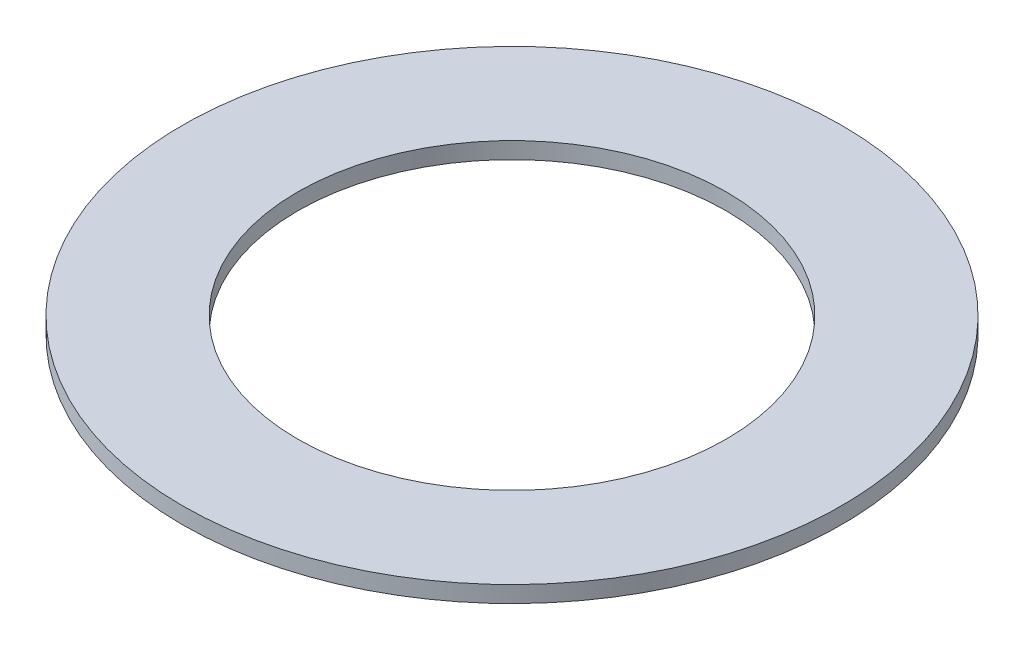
SolidWorks part; units mm, degrees
ref_plane "Front" through (0, 0, 0) normal (0, 0, 1) x (1, 0, 0)
ref_plane "Top" through (0, 0, 0) normal (0, 1, 0) x (1, 0, 0)
ref_plane "Side" through (0, 0, 0) normal (1, 0, 0) x (0, 0, -1)
sketch "Sketch1" plane through (0, 0, 0) normal (0, 0, 1) x (1, 0, 0)
  line L0 (0, 0) -> (0, 0.5) construction
  line L1 (6.5, 0) -> (6.5, 0.5)
  line L2 (6.5, 0.5) -> (10, 0.5)
  line L3 (10, 0.5) -> (10, 0)
  line L4 (10, 0) -> (6.5, 0)
  dimension "D1" = 13
  dimension "D2" = 20
  dimension "D3" = 0.5
revolve "Base-Revolve" add sketch "Sketch1" angle 360 about L0
